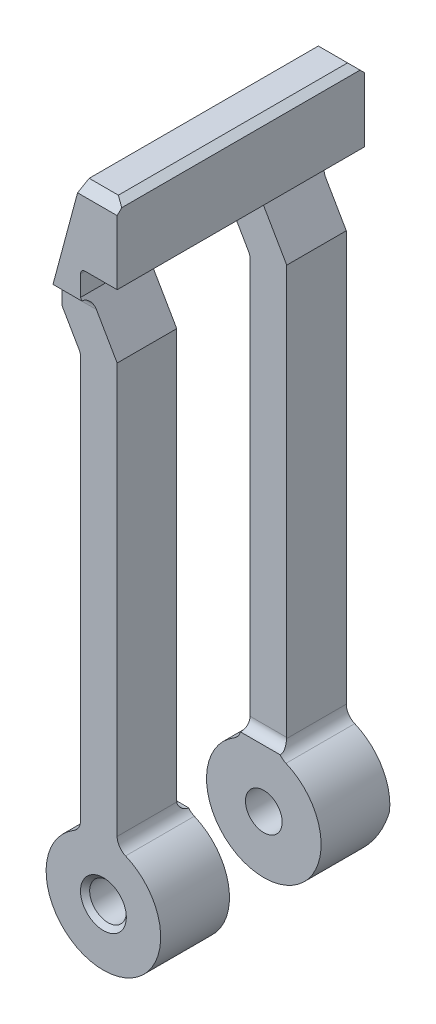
SolidWorks part; units mm, degrees
ref_plane "Plan1" through (0, 0, 0) normal (0, 0, 1) x (1, 0, 0)
ref_plane "Plan2" through (0, 0, 0) normal (0, 1, 0) x (1, 0, 0)
ref_plane "Plan3" through (0, 0, 0) normal (1, 0, 0) x (0, 0, -1)
sketch "Esquisse1" plane through (0, 0, 0) normal (0, 0, 1) x (1, 0, 0)
  line L0 (0, -22.9) -> (0, 103.9) construction
  line L1 (-5, 13.2759) -> (-5, 101.0641)
  line L2 (3, 14.2916) -> (3, 103.7436)
  line L3 (3, 103.7436) -> (-3, 114.1359)
  line L4 (-3, 114.1359) -> (-3, 118.6)
  line L5 (-2, 119.6) -> (5, 119.6)
  line L6 (5, 119.6) -> (5, 134.6)
  line L7 (3.2679, 135.6) -> (-3.1051, 135.6)
  line L8 (-3.1051, 135.6) -> (-9, 113.6)
  line L9 (-9, 113.6) -> (-9, 108.5282)
  line L10 (-9, 108.5282) -> (-5.2679, 102.0641)
  line L11 (3.2679, 135.6) -> (5, 134.6)
  circle A0 centre (0, 0) radius 4
  arc A1 (-6.4516, 10.7064) -> (4.8387, 11.5255) centre (0, 0) ccw
  arc A2 (-6.4516, 10.7064) -> (-5, 13.2759) centre (-8, 13.2759) ccw
  arc A3 (4.8387, 11.5255) -> (3, 14.2916) centre (6, 14.2916) cw
  arc A4 (-5, 101.0641) -> (-5.2679, 102.0641) centre (-7, 101.0641) ccw
  arc A5 (-3, 118.6) -> (-2, 119.6) centre (-2, 118.6) cw
  point P22 (-5, 101.6)
  dimension "D1" = 8
  dimension "D2" = 25
  dimension "D15" = 3
  dimension "D16" = 2
  dimension "D17" = 1
  dimension "D3" = 8
  dimension "D4" = 14
  dimension "D5" = 4
  dimension "D6" = 8
  dimension "D7" = 16
  dimension "D8" = 30
  dimension "D9" = 5
  dimension "D10" = 135.6
  dimension "D11" = 8
  dimension "D12" = 22
  dimension "D13" = 15
  dimension "D14" = 34
  dimension "D18" = 1
  dimension "D19" = 30
extrude "Base-Extrusion" add sketch "Esquisse1" along normal blind 54
sketch "Esquisse4" plane through (-5, 0, 0) normal (-1, 0, 0) x (0, 0, 1)
  line L0 (52, 111.6) -> (52, -12.5)
  line L1 (52, -12.5) -> (37, -12.5)
  line L2 (39, 14.5) -> (39, 113.6)
  line L3 (39, 113.6) -> (15, 113.6)
  line L4 (15, 113.6) -> (15, 14.5)
  line L5 (17, -12.5) -> (5, -12.5)
  line L6 (2, -1.3038) -> (2, 111.6)
  line L7 (27, 101.0641) -> (27, -19.3312) construction
  line L8 (54, 101.0641) -> (0, 101.0641) construction
  line L11 (54, 101.0641) -> (0, 101.0641) construction
  line L12 (0, 101.0641) -> (0, 13.2759) construction
  line L14 (54, 135.6) -> (0, 135.6) construction
  line L15 (37, 12.5) -> (37, -12.5)
  line L16 (17, 12.5) -> (17, -12.5)
  line L17 (5, -12.5) -> (2, -1.3038)
  line L18 (67, 113.6) -> (54, 113.6)
  line L19 (0, 113.6) -> (-15.1, 113.6)
  line L22 (0, -12.5) -> (54, -12.5) construction
  line L23 (67, 113.6) -> (67, -33)
  line L24 (67, -33) -> (-15.1, -33)
  line L25 (-15.1, -33) -> (-15.1, 113.6)
  arc A0 (0, 113.6) -> (2, 111.6) centre (0, 111.6) cw
  arc A1 (54, 113.6) -> (52, 111.6) centre (54, 111.6) ccw
  arc A2 (37, 12.5) -> (39, 14.5) centre (37, 14.5) ccw
  arc A3 (15, 14.5) -> (17, 12.5) centre (17, 14.5) ccw
  dimension "D10" = 2
  dimension "D11" = 2
  dimension "D14" = 2
  dimension "D1" = 2
  dimension "D2" = 13
  dimension "D3" = 24
  dimension "D4" = 13
  dimension "D5" = 22
  dimension "D6" = 15
  dimension "D7" = 20
  dimension "D8" = 10
  dimension "D9" = 15
  dimension "D12" = 25
  dimension "D13" = 25
extrude "Enlèv. mat.-Extru.4" cut sketch "Esquisse4" against normal mid plane 50
chamfer "Chanfrein1" distance 1 angle 45
chamfer "Chanfrein2" distance 2 angle 45
